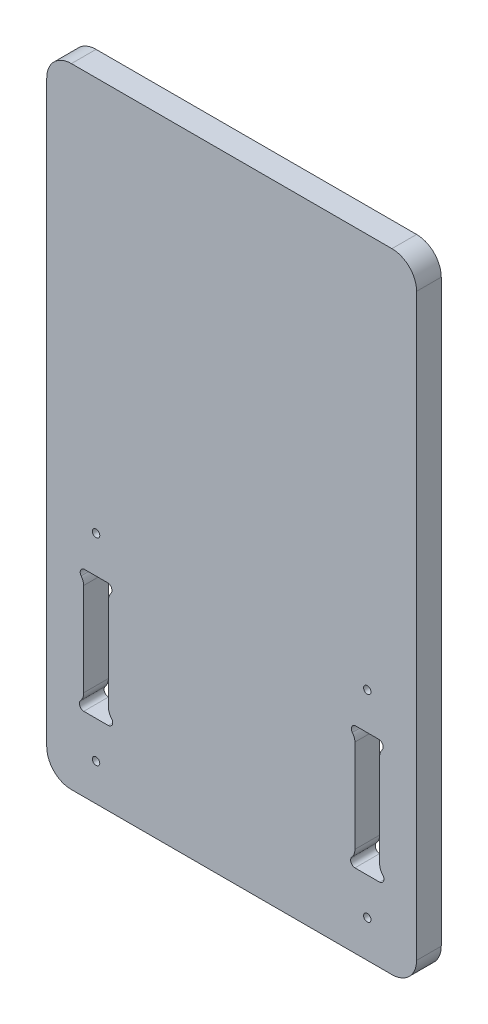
SolidWorks part; units mm, degrees
ref_plane "Plan de face" through (0, 0, 0) normal (0, 0, 1) x (1, 0, 0)
ref_plane "Plan de dessus" through (0, 0, 0) normal (0, 1, 0) x (1, 0, 0)
ref_plane "Plan de droite" through (0, 0, 0) normal (1, 0, 0) x (0, 0, -1)
sketch "Esquisse1" plane through (0, 0, 0) normal (0, 0, 1) x (1, 0, 0)
  line L4 (-65.5101, -55) -> (65.1021, -55)
  line L5 (75, -45) -> (75, 190)
  line L7 (-75, 190) -> (-75, -45)
  line L8 (-50, -25) -> (-60, -25)
  line L9 (-60, -18.4906) -> (-60, 19.1989)
  line L10 (-60, 25) -> (-50, 25)
  line L12 (-55, -104.8826) -> (-55, 70.6245) construction
  line L13 (-50, -18.4906) -> (-50, 19.1989)
  line L14 (-65, 200) -> (65, 200)
  line L15 (55, 0) -> (-55, 0) construction
  line L16 (0, -55) -> (0, 55) construction
  line L17 (55, -104.8826) -> (55, 70.6245) construction
  line L18 (50, -18.4906) -> (50, 19.1989)
  line L19 (60, 25) -> (50, 25)
  line L20 (60, -18.4906) -> (60, 19.1989)
  line L21 (50, -25) -> (60, -25)
  arc A8 (-75, -45) -> (-65.5101, -55) centre (-65, -45.013) ccw
  arc A9 (65.1021, -55) -> (75, -45) centre (65, -45.0005) ccw
  arc A14 (-61.3779, -21.9779) -> (-60, -25) centre (-59.8722, -23.1166) ccw
  arc A15 (-61.3779, -21.9779) -> (-60, -18.4906) centre (-65.102, -18.4906) ccw
  arc A16 (-60, 19.1989) -> (-61.0488, 22.0156) centre (-65.0936, 18.9059) ccw
  arc A17 (-60, 25) -> (-61.0488, 22.0156) centre (-59.5522, 23.1661) ccw
  circle A22 centre (-55, -40) radius 1.5
  arc A24 (-48.6221, -21.9779) -> (-50, -18.4906) centre (-44.898, -18.4906) cw
  arc A25 (-48.6221, -21.9779) -> (-50, -25) centre (-50.1278, -23.1166) cw
  arc A26 (-50, 19.1989) -> (-48.9512, 22.0156) centre (-44.9064, 18.9059) cw
  arc A27 (-50, 25) -> (-48.9512, 22.0156) centre (-50.4478, 23.1661) cw
  arc A28 (-75, 190) -> (-65, 200) centre (-65, 190) cw
  arc A29 (75, 190) -> (65, 200) centre (65, 190) ccw
  circle A30 centre (-55, 40) radius 1.5
  arc A31 (48.6221, -21.9779) -> (50, -25) centre (50.1278, -23.1166) ccw
  arc A32 (48.6221, -21.9779) -> (50, -18.4906) centre (44.898, -18.4906) ccw
  arc A33 (50, 19.1989) -> (48.9512, 22.0156) centre (44.9064, 18.9059) ccw
  arc A34 (50, 25) -> (48.9512, 22.0156) centre (50.4478, 23.1661) ccw
  arc A35 (60, 25) -> (61.0488, 22.0156) centre (59.5522, 23.1661) cw
  arc A36 (60, 19.1989) -> (61.0488, 22.0156) centre (65.0936, 18.9059) cw
  arc A37 (61.3779, -21.9779) -> (60, -18.4906) centre (65.102, -18.4906) cw
  arc A38 (61.3779, -21.9779) -> (60, -25) centre (59.8722, -23.1166) cw
  circle A39 centre (55, -40) radius 1.5
  circle A40 centre (55, 40) radius 1.5
  dimension "D7" = 10
  dimension "D8" = 10
  dimension "D9" = 10
  dimension "D10" = 10
  dimension "D11" = 3
  dimension "D13" = 75
  dimension "D1" = 50
  dimension "D2" = 50
  dimension "D3" = 25
  dimension "D4" = 5
  dimension "D5" = 55
  dimension "D6" = 200
  dimension "D12" = 40
  dimension "D14" = 75
extrude "Boss.-Extru.1" add sketch "Esquisse1" along normal blind 10
